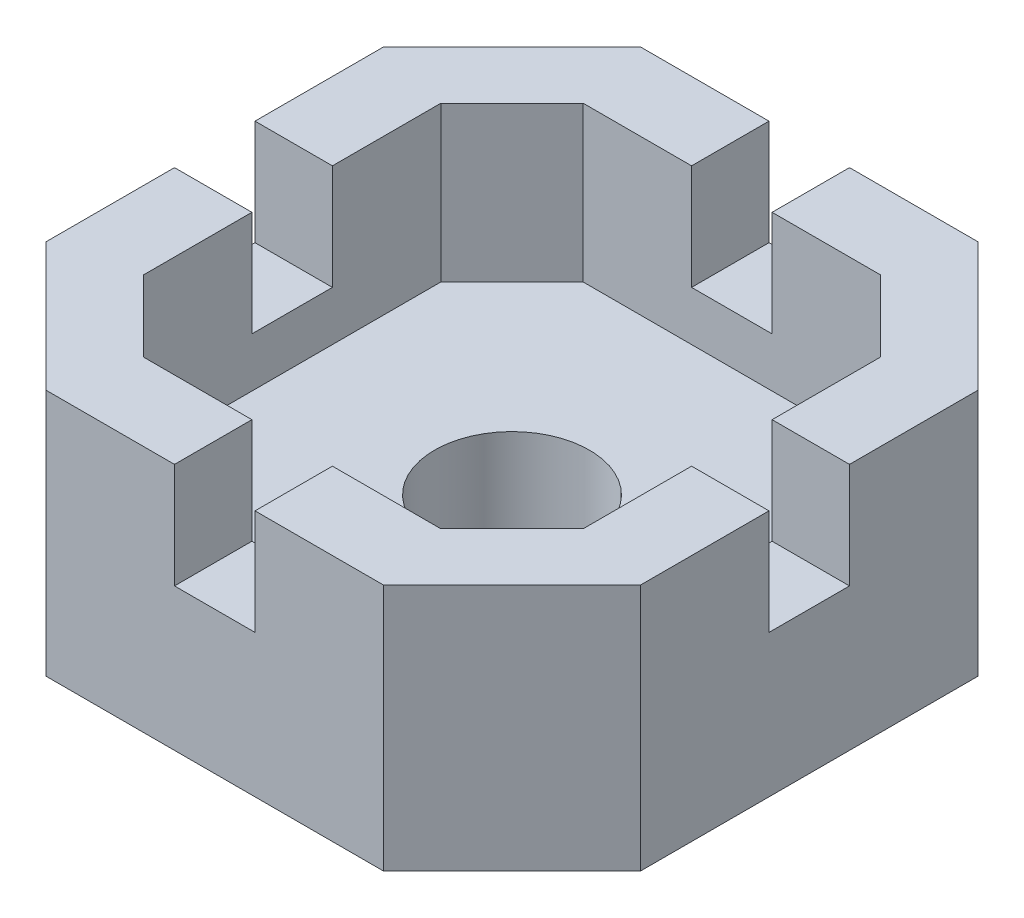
SolidWorks part; units mm, degrees
ref_plane "Front Plane" through (0, 0, 0) normal (0, 0, 1) x (1, 0, 0)
ref_plane "Top Plane" through (0, 0, 0) normal (0, 1, 0) x (1, 0, 0)
ref_plane "Right Plane" through (0, 0, 0) normal (1, 0, 0) x (0, 0, -1)
sketch "Sketch1" plane through (0, 0, 0) normal (0, 1, 0) x (1, 0, 0)
  line L0 (-9.017, 0) -> (9.017, 0) construction
  line L1 (0, 9.017) -> (0, -9.017) construction
  line L2 (-6.096, 9.017) -> (6.096, 9.017)
  line L3 (6.096, 9.017) -> (9.017, 6.096)
  line L4 (9.017, 6.096) -> (9.017, -6.096)
  line L5 (9.017, -6.096) -> (6.096, -9.017)
  line L6 (6.096, -9.017) -> (-6.096, -9.017)
  line L7 (-6.096, -9.017) -> (-9.017, -6.096)
  line L8 (-9.017, -6.096) -> (-9.017, 6.096)
  line L9 (-9.017, 6.096) -> (-6.096, 9.017)
  line L10 (6.096, 9.017) -> (6.096, -9.017) construction
  line L11 (9.017, 6.096) -> (-9.017, 6.096) construction
  line L12 (-12.192, 12.192) -> (-12.192, -12.192)
  line L13 (-12.192, -12.192) -> (12.192, -12.192)
  line L14 (12.192, -12.192) -> (12.192, 12.192)
  line L15 (12.192, 12.192) -> (-12.192, 12.192)
  point P0 (0, 0)
  dimension "D1" = 12.192
  dimension "D2" = 45
  dimension "D3" = 18.034
  dimension "D4" = 3.175
  dimension "D5" = 3.175
  dimension "D6" = 3.175
  dimension "D7" = 3.175
extrude "Boss-Extrude1" add sketch "Sketch1" along normal blind 6.35
sketch "Sketch2" plane through (0, 0, 0) normal (0, -1, 0) x (1, 0, 0)
  line L1 (12.192, 12.192) -> (-12.192, 12.192)
  line L2 (12.192, 12.192) -> (12.192, -12.192)
  line L3 (12.192, -12.192) -> (-12.192, -12.192)
  line L4 (-12.192, 12.192) -> (-12.192, -12.192)
  line L5 (12.192, 12.192) -> (-12.192, -12.192) construction
  line L6 (12.192, -12.192) -> (-12.192, 12.192) construction
  circle A0 centre (0, 0) radius 3.175
  point P4 (0, 0)
  dimension "D1" = 6.35
extrude "Boss-Extrude2" add sketch "Sketch2" along normal blind 3.81
sketch "Sketch3" plane through (0, 6.35, 0) normal (0, 1, 0) x (1, 0, 0)
  line L0 (0, -12.192) -> (0, 12.192) construction
  line L1 (-12.192, -12.192) -> (12.192, -12.192) construction
  line L2 (12.192, 12.192) -> (-12.192, 12.192) construction
  line L3 (12.192, 0) -> (-12.192, 0) construction
  line L4 (12.192, -12.192) -> (12.192, 12.192) construction
  line L5 (-12.192, 12.192) -> (-12.192, -12.192) construction
  line L7 (1.5875, 12.192) -> (-1.5875, 12.192)
  line L8 (1.5875, 12.192) -> (1.5875, -12.192)
  line L9 (1.5875, -12.192) -> (-1.5875, -12.192)
  line L10 (-1.5875, 12.192) -> (-1.5875, -12.192)
  line L11 (1.5875, 12.192) -> (-1.5875, -12.192) construction
  line L12 (1.5875, -12.192) -> (-1.5875, 12.192) construction
  line L13 (12.192, 1.5875) -> (-12.192, 1.5875)
  line L14 (12.192, 1.5875) -> (12.192, -1.5875)
  line L15 (12.192, -1.5875) -> (-12.192, -1.5875)
  line L16 (-12.192, 1.5875) -> (-12.192, -1.5875)
  line L17 (12.192, 1.5875) -> (-12.192, -1.5875) construction
  line L18 (12.192, -1.5875) -> (-12.192, 1.5875) construction
  point P12 (0, 0)
  point P17 (0, 0)
  dimension "D1" = 3.175
extrude "Cut-Extrude1" cut sketch "Sketch3" against normal blind 4.318 contours L10 L8 M19 M9 | L15 L13 M10 M17 | L15 L13 M13 M12 | L10 L8 M11 M15
sketch "Sketch4" plane through (0, 6.35, 0) normal (0, 1, 0) x (1, 0, 0)
  line L2 (-12.192, -6.9215) -> (-12.192, 6.9215)
  line L3 (-12.192, -1.651) -> (-12.192, -12.192) construction
  line L4 (-12.192, 12.192) -> (-12.192, 1.651) construction
  line L5 (-12.192, -6.9215) -> (-6.9215, -12.192)
  line L7 (-12.192, -12.192) -> (-1.651, -12.192) construction
  line L8 (-6.9215, -12.192) -> (6.9215, -12.192)
  line L9 (1.651, -12.192) -> (12.192, -12.192) construction
  line L10 (6.9215, -12.192) -> (12.192, -6.9215)
  line L11 (12.192, -12.192) -> (12.192, -1.651) construction
  line L12 (12.192, -6.9215) -> (12.192, 6.9215)
  line L13 (12.192, 1.651) -> (12.192, 12.192) construction
  line L14 (12.192, 6.9215) -> (6.9215, 12.192)
  line L15 (12.192, 12.192) -> (1.651, 12.192) construction
  line L16 (6.9215, 12.192) -> (-6.9215, 12.192)
  line L17 (-1.651, 12.192) -> (-12.192, 12.192) construction
  line L18 (-6.9215, 12.192) -> (-12.192, 6.9215)
  line L19 (-6.9215, -12.192) -> (-12.192, -12.192)
  line L20 (-12.192, -12.192) -> (-12.192, -6.9215)
  line L21 (-12.192, 6.9215) -> (-12.192, 12.192)
  line L22 (-12.192, 12.192) -> (-6.9215, 12.192)
  line L23 (6.9215, -12.192) -> (12.192, -12.192)
  line L24 (12.192, -12.192) -> (12.192, -6.9215)
  line L25 (12.192, 6.9215) -> (12.192, 12.192)
  line L26 (12.192, 12.192) -> (6.9215, 12.192)
  point P16 (0, 0)
  point P45 (0, 0)
extrude "Cut-Extrude2" cut sketch "Sketch4" against normal through all contours L23 L24 L10 | L5 M2 M4 | L22 L21 L18 | L25 L26 L14
